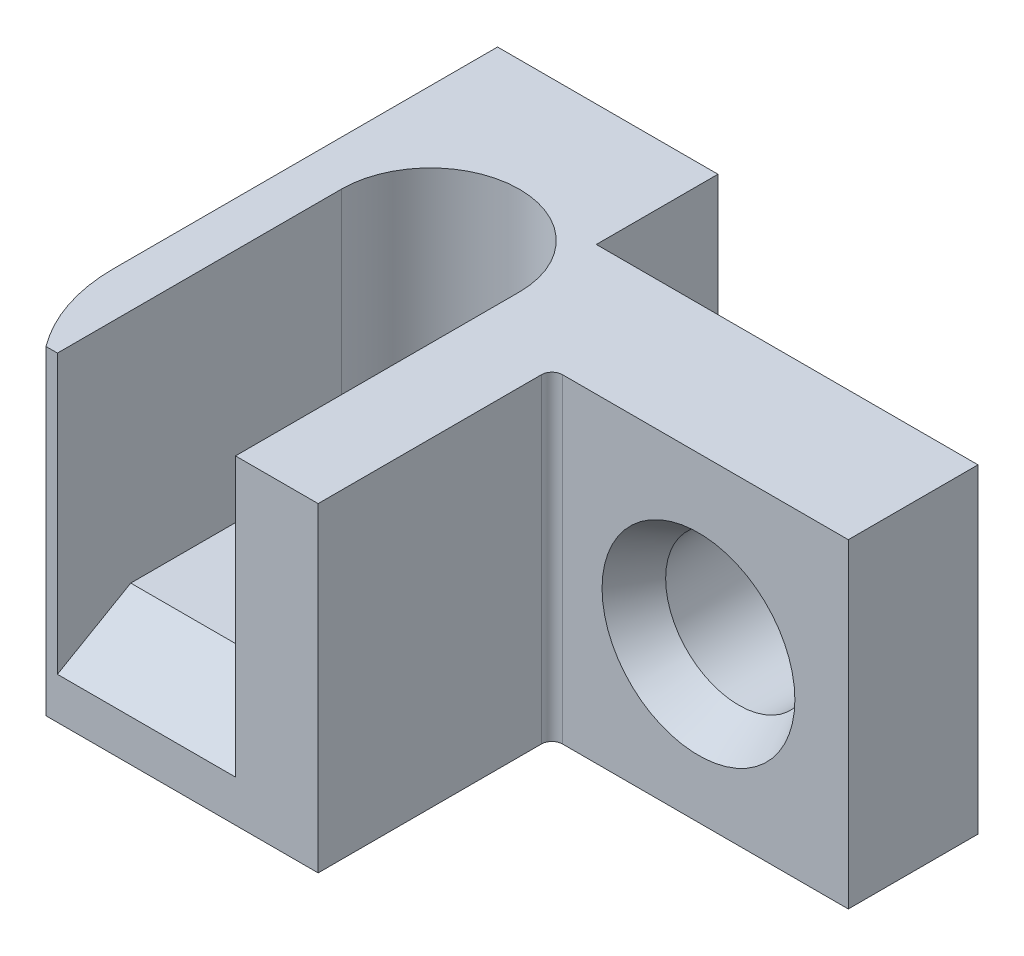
SolidWorks part; units mm, degrees
ref_plane "Спереди" through (0, 0, 0) normal (0, 0, 1) x (1, 0, 0)
ref_plane "Сверху" through (0, 0, 0) normal (0, 1, 0) x (1, 0, 0)
ref_plane "Справа" through (0, 0, 0) normal (1, 0, 0) x (0, 0, -1)
sketch "Эскиз1" plane through (0, 0, 0) normal (0, 1, 0) x (1, 0, 0)
  line L0 (0, 0) -> (8.3312, 0)
  line L1 (8.3312, 0) -> (8.3312, -4.5974)
  line L2 (8.3312, -4.5974) -> (22.7584, -4.5974)
  line L3 (22.7584, -4.5974) -> (22.7584, -9.4996)
  line L4 (22.7584, -9.4996) -> (11.9539, -9.4996)
  line L5 (11.557, -9.8965) -> (11.557, -18.3388)
  line L6 (11.557, -18.3388) -> (1.27, -18.3388)
  line L7 (0, -14.5288) -> (0, 0)
  arc A0 (1.27, -18.3388) -> (0, -14.5288) centre (6.35, -14.5288) cw
  arc A2 (11.9539, -9.4996) -> (11.557, -9.8965) centre (11.9539, -9.8965) ccw
  dimension "D7" = 6.35
  dimension "D1" = 8.3312
  dimension "D2" = 8.8392
  dimension "D3" = 13.7414
  dimension "D4" = 22.7584
  dimension "D5" = 18.3388
  dimension "D6" = 11.557
  dimension "D8" = 1.27
extrude "Бобышка-Вытянуть1" add sketch "Эскиз1" along normal blind 12.0904
sketch "Эскиз2" plane through (0, 0, 9.4996) normal (0, 0, 1) x (1, 0, 0)
  line L0 (8.3312, 12.0904) -> (8.3312, 0) construction
  circle A0 centre (17.0942, 5.842) radius 2.7648
  dimension "D1" = 5.5296
  dimension "D2" = 5.842
  dimension "D3" = 8.763
extrude "Вырез-Вытянуть1" cut sketch "Эскиз2" against normal through all
sketch "Эскиз3" plane through (0, 12.0904, 0) normal (0, 1, 0) x (1, 0, 0)
  line L0 (1.7018, -7.6073) -> (1.7018, -18.3388)
  line L1 (1.27, -18.3388) -> (11.557, -18.3388) construction
  line L2 (1.7018, -18.3388) -> (8.4328, -18.3388)
  line L3 (8.4328, -18.3388) -> (8.4328, -7.6073)
  line L4 (0, 0) -> (0, -14.5288) construction
  arc A0 (8.4328, -7.6073) -> (1.7018, -7.6073) centre (5.0673, -7.6073) ccw
  point P7 (5.0673, -4.2418)
  dimension "D1" = 14.097
  dimension "D2" = 6.731
  dimension "D3" = 1.7018
extrude "Вырез-Вытянуть2" cut sketch "Эскиз3" against normal offset from surface (8.9154 mm away) 3.175
sketch "Эскиз4" plane through (1.7018, 0, 0) normal (1, 0, 0) x (0, 0, -1)
  line L0 (-15.5672, 3.175) -> (-18.3388, 3.175)
  line L1 (-18.3388, 3.175) -> (-7.6073, 3.175) construction
  line L2 (-18.3388, 3.175) -> (-18.3388, 1.5748)
  line L3 (-18.3388, 1.5748) -> (-15.5672, 3.175)
  line L4 (0, 0) -> (-14.5288, 0) construction
  dimension "D1" = 1.5748
  dimension "D2" = 30
extrude "Вырез-Вытянуть3" cut sketch "Эскиз4" along normal up to surface (6.731 mm away)
sketch "Эскиз5" plane through (0, 0, 0) normal (0, 0, -1) x (-1, 0, 0)
  line L0 (-5.0292, 0) -> (-8.3312, 0)
  line L1 (-8.3312, 0) -> (0, 0) construction
  line L2 (-8.3312, 0) -> (-8.3312, 3.302)
  line L4 (-8.3312, 12.0904) -> (-8.3312, 0) construction
  arc A0 (-5.0292, 0) -> (-8.3312, 3.302) centre (-5.0292, 3.302) cw
  dimension "D1" = 3.302
extrude "Вырез-Вытянуть4" cut sketch "Эскиз5" against normal up to surface (4.5974 mm away)
chamfer "Фаска1" distance 1.524 angle 30 1 edges at (19.859, 5.842, 9.4996)
